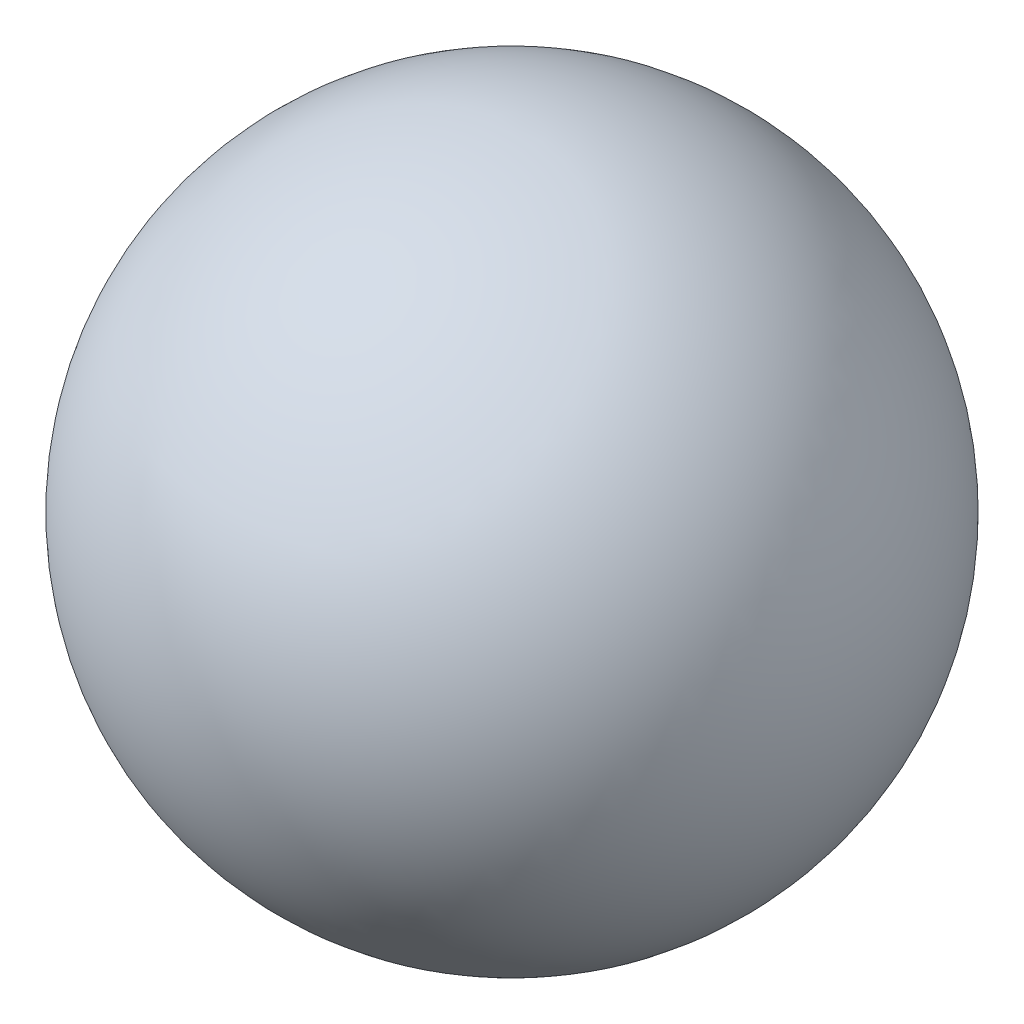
SolidWorks part; units mm, degrees
ref_plane "Front" through (0, 0, 0) normal (0, 0, 1) x (1, 0, 0)
ref_plane "Top" through (0, 0, 0) normal (0, 1, 0) x (1, 0, 0)
ref_plane "Right" through (0, 0, 0) normal (1, 0, 0) x (0, 0, -1)
sketch "Sketch1" plane through (0, 0, 0) normal (0, 0, 1) x (1, 0, 0)
  line L0 (0, 0) -> (0, 2.9845)
  line L1 (0, 0) -> (0, -0.2023)
  line L2 (0, -2.9845) -> (0, -0.2023)
  arc A0 (0, -2.9845) -> (0, 2.9845) centre (0, 0) ccw
  dimension "D1" = 5.969
revolve "Revolve7" add sketch "Sketch1" angle 360 about L0
